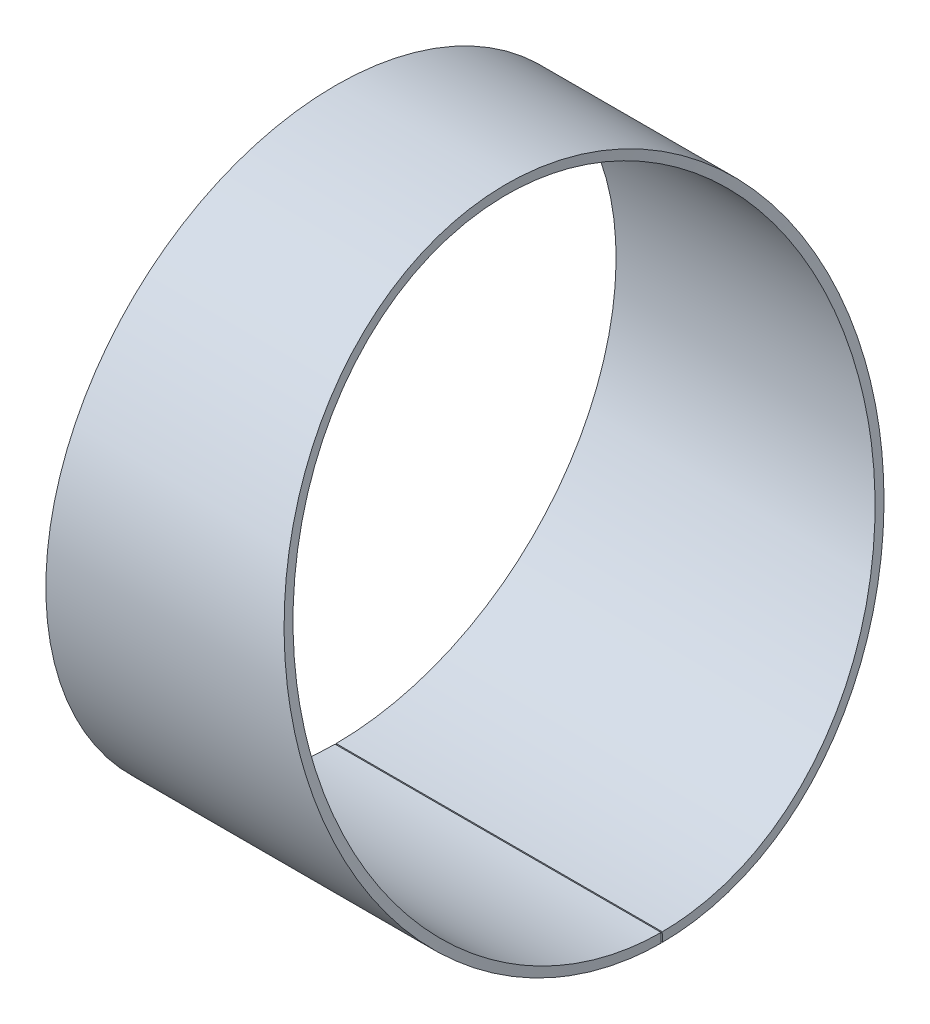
SolidWorks part; units mm, degrees
ref_plane "前视基准面" through (0, 0, 0) normal (0, 0, 1) x (1, 0, 0)
ref_plane "上视基准面" through (0, 0, 0) normal (0, 1, 0) x (1, 0, 0)
ref_plane "右视基准面" through (0, 0, 0) normal (1, 0, 0) x (0, 0, -1)
imported_body "基体零件-人字形三通管-1"
sheet metal parameters "钣金1" parameters "D1"=0.7366, "厚度"=8
bend "圆角折弯1" bend radius 242 bend angle 359.771 parameters "D5"=1
flatten bends "展开-折弯1" parameters "D1"=0
sketch "尖角-草图1" plane through (-659.3267, -1049.9995, -0.5) normal (0, -1, -0.002) x (1, 0, 0)
  line L0 (140.6733, -759.7814) -> (-140.6733, -759.7814) construction
process bends "加工-折弯1" parameters "D1"=0
sketch "平面-草图1" plane through (-659.3267, -1049.9995, -0.5) normal (0, -1, -0.002) x (1, 0, 0)
